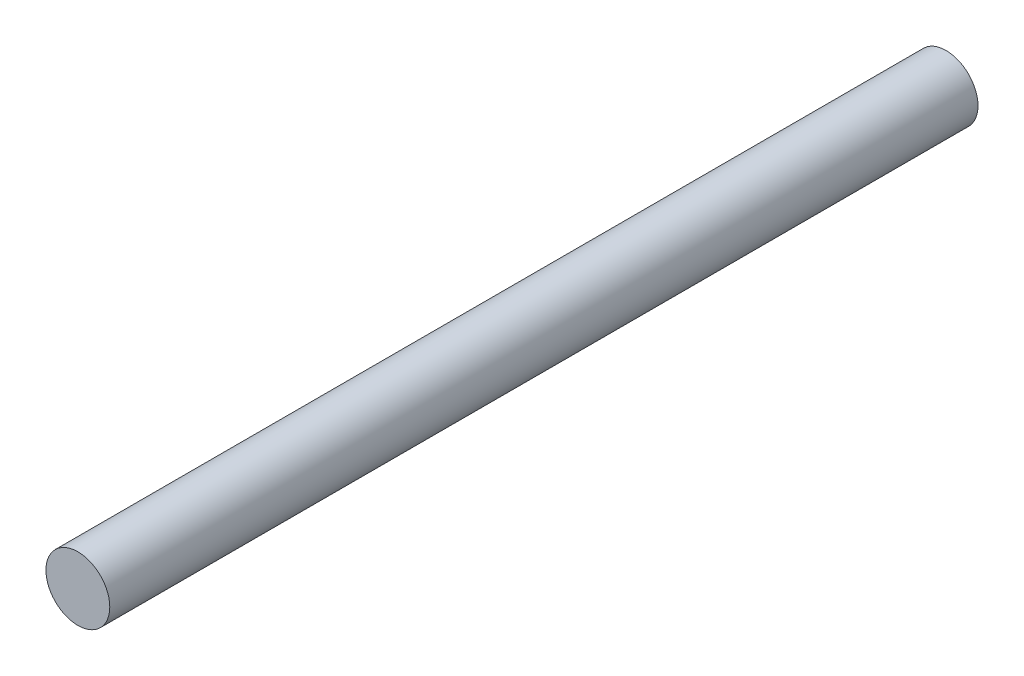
SolidWorks part; units mm, degrees
ref_plane "Front Plane" through (0, 0, 0) normal (0, 0, 1) x (1, 0, 0)
ref_plane "Top Plane" through (0, 0, 0) normal (0, 1, 0) x (1, 0, 0)
ref_plane "Right Plane" through (0, 0, 0) normal (1, 0, 0) x (0, 0, -1)
sketch "Sketch1" plane through (0, 0, 0) normal (0, 0, 1) x (1, 0, 0)
  circle A0 centre (0, 0) radius 1.5
  dimension "D1" = 3
extrude "Boss-Extrude1" add sketch "Sketch1" along normal blind 40.8
sketch "Sketch2" plane through (0, 0, 0) normal (0, 0, -1) x (-1, 0, 0)
  point P0 (0, 0)
sketch "Sketch3" plane through (0, 0, 40.8) normal (0, 0, 1) x (1, 0, 0)
  point P0 (0, 0)
